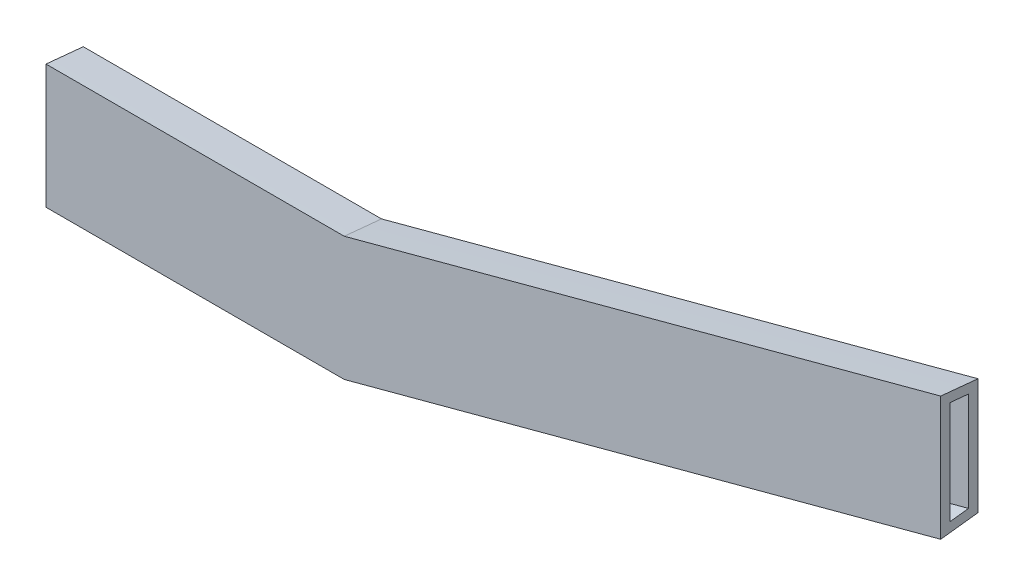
SolidWorks part; units mm, degrees
ref_plane "Front Plane" through (0, 0, 0) normal (0, 0, 1) x (1, 0, 0)
ref_plane "Top Plane" through (0, 0, 0) normal (0, 1, 0) x (1, 0, 0)
ref_plane "Right Plane" through (0, 0, 0) normal (1, 0, 0) x (0, 0, -1)
curve "Curve1"
sketch "Sketch1" plane through (0, 0, 0) normal (1, 0, 0) x (0, 0, -1)
  line L0 (64.2938, 17.9381) -> (64.2938, 7.3735)
  line L1 (0, 0) -> (0, 95.7684) construction
  line L4 (67.4688, 17.6298) -> (67.4688, 7.7502)
  line L5 (65.0938, 17.0589) -> (65.0938, 8.2772)
  line L6 (66.6687, 16.9056) -> (66.6687, 8.4636)
  spline S0 degree 1 poles (65.0938, 8.2772) (66.6687, 8.4636) knots 0 0 1 1 construction
  spline S1 degree 1 poles (66.6687, 16.9056) (65.0938, 17.0589) knots 0 0 1 1 construction
  spline S2 degree 3 poles (65.0938, 8.2772) (65.6186, 8.3406) (66.1436, 8.4027) (66.6687, 8.4636) knots 0.731305 0.731305 0.731305 0.731305 0.736464 0.736464 0.736464 0.736464
  spline S3 degree 3 poles (66.6687, 16.9056) (66.1438, 16.9577) (65.6189, 17.0088) (65.0938, 17.0589) knots 1.268574 1.268574 1.268574 1.268574 1.273764 1.273764 1.273764 1.273764
  spline S5 degree 3 poles (64.2938, 7.3735) (65.3515, 7.504) (66.4098, 7.6297) (67.4688, 7.7502) knots 0.728362 0.728362 0.728362 0.728362 0.738787 0.738787 0.738787 0.738787
  spline S6 degree 3 poles (67.4688, 17.6298) (66.4108, 17.7363) (65.3525, 17.8393) (64.2938, 17.9381) knots 1.266201 1.266201 1.266201 1.266201 1.276646 1.276646 1.276646 1.276646
  dimension "D1" = 0.8001
extrude "Boss-Extrude1" add sketch "Sketch1" along normal blind 25.4
ref_plane "Plane1" through (76.2, 0, 0) normal (1, 0, 0) x (0, 0, -1)
sketch "Sketch2" plane through (0, 0, -64.2937) normal (0, 0, 1) x (1, 0, 0)
  line L0 (25.4, 7.3735) -> (76.2, 7.3735) construction
  line L1 (76.2, -1.7462) -> (76.2, 1.7463) construction
  line L2 (25.4, 7.3735) -> (76.2, 20.9853)
  dimension "D1" = 15
sketch "Sketch3" plane through (25.4, 0, 0) normal (1, 0, 0) x (0, 0, -1)
  line L2 (65.0938, 17.0589) -> (65.0938, 8.2772)
  line L3 (66.6687, 8.4636) -> (66.6687, 16.9056)
  line L4 (65.0938, 17.0589) -> (65.0938, 8.2772)
  line L5 (66.6687, 8.4636) -> (66.6687, 16.9056)
  line L6 (64.2938, 17.9381) -> (64.2938, 7.3735)
  line L7 (67.4688, 7.7502) -> (67.4688, 17.6298)
  line L8 (64.2938, 17.9381) -> (64.2938, 7.3735)
  line L9 (67.4688, 7.7502) -> (67.4688, 17.6298)
  arc A2 (66.6687, 8.4636) -> (65.0938, 8.2772) centre (105.3869, -325.35) ccw
  arc A3 (66.6687, 16.9056) -> (65.0938, 17.0589) centre (23.3236, -420.3542) ccw
  arc A4 (66.6687, 8.4636) -> (65.0938, 8.2772) centre (105.3869, -325.35) ccw
  arc A5 (66.6687, 16.9056) -> (65.0938, 17.0589) centre (23.3236, -420.3542) ccw
  spline S2 degree 3 poles (119.6461, 2956.7409) (-900.6484, -3170.3465) (726.6922, 3146.0713) (392.6353, -2925.1901) knots -1.938074 -1.938074 -1.938074 -1.938074 2.956328 2.956328 2.956328 2.956328 only from (64.2938, 7.3735) to (67.4688, 7.7502)
  spline S3 degree 3 poles (686.639, 2925.5717) (127.9611, -2970.4064) (45.8681, 3002.9346) (-554.569, -2894.7055) knots -0.417714 -0.417714 -0.417714 -0.417714 2.85636 2.85636 2.85636 2.85636 only from (67.4688, 17.6298) to (64.2938, 17.9381)
  spline S4 degree 3 poles (64.2938, 7.3735) (65.3515, 7.504) (66.4098, 7.6297) (67.4688, 7.7502) knots 0.728362 0.728362 0.728362 0.728362 0.738787 0.738787 0.738787 0.738787
  spline S5 degree 3 poles (67.4688, 17.6298) (66.4108, 17.7363) (65.3525, 17.8393) (64.2938, 17.9381) knots 1.266201 1.266201 1.266201 1.266201 1.276646 1.276646 1.276646 1.276646
  dimension "D1" = 0
  dimension "D2" = 0
sweep "Sweep1" add profiles "Sketch3" path "Sketch2"
